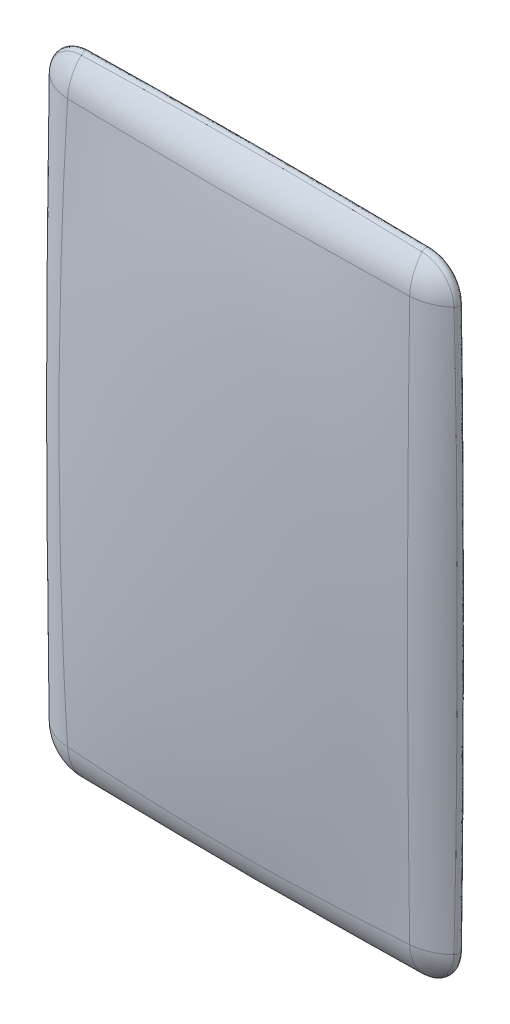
SolidWorks part; units mm, degrees
ref_plane "Front Plane" through (0, 0, 0) normal (0, 0, 1) x (1, 0, 0)
ref_plane "Top Plane" through (0, 0, 0) normal (0, 1, 0) x (1, 0, 0)
ref_plane "Right Plane" through (0, 0, 0) normal (1, 0, 0) x (0, 0, -1)
sketch "Sketch1" plane through (0, 0, 0) normal (0, 0, 1) x (1, 0, 0)
  line L12 (-210, 320) -> (-210, -320)
  line L13 (-210, -320) -> (210, -320)
  line L14 (210, -320) -> (210, 320)
  line L15 (210, 320) -> (-210, 320)
extrude "Boss-Extrude1" add sketch "Sketch1" along normal blind 20
fillet "Fillet2" radius 40 4 edges at (-210, 320, 10) (210, 320, 10) (210, -320, 10) (-210, -320, 10)
other "Freeform1"
fillet "Fillet4" radius 50 4 edges
fillet "Fillet5" radius 5 8 edges
